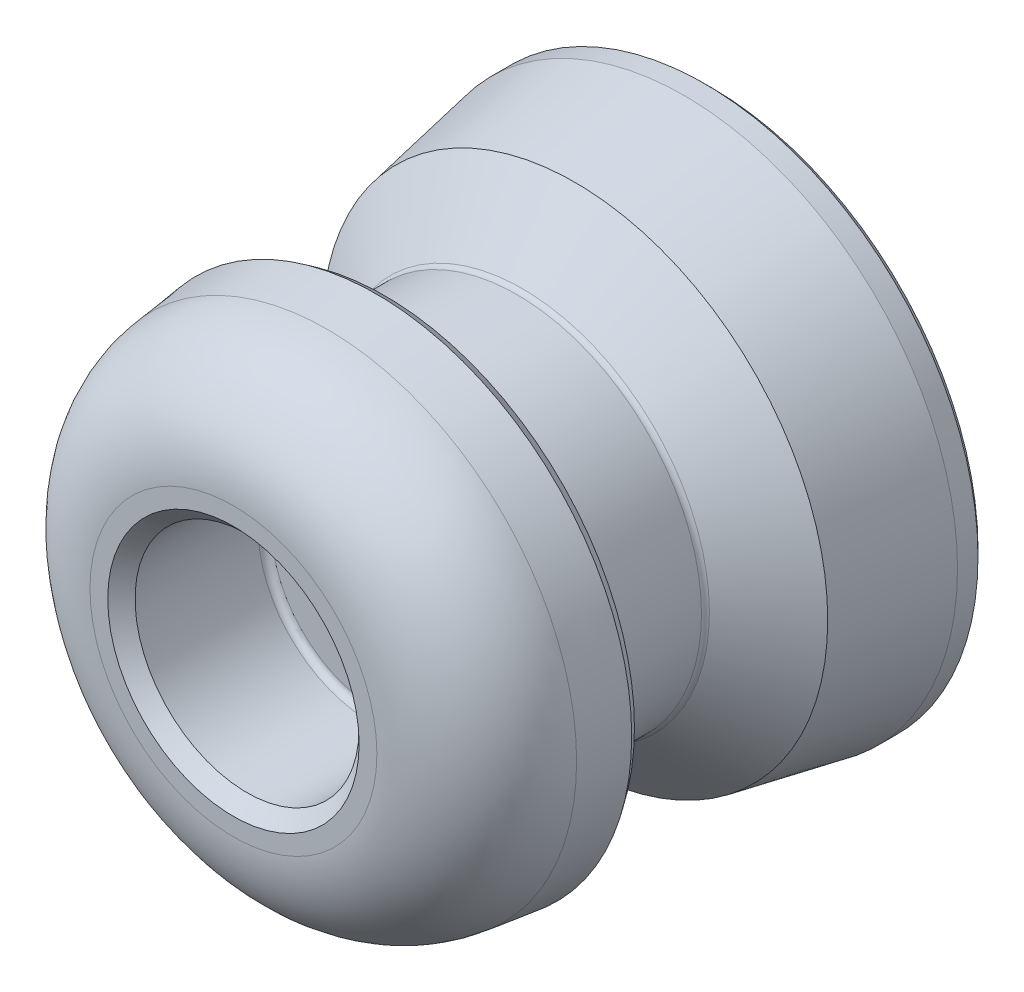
SolidWorks part; units mm, degrees
ref_plane "Přední rovina" through (0, 0, 0) normal (0, 0, 1) x (1, 0, 0)
ref_plane "Horní rovina" through (0, 0, 0) normal (0, 1, 0) x (1, 0, 0)
ref_plane "Pravá rovina" through (0, 0, 0) normal (1, 0, 0) x (0, 0, -1)
sketch "Skica1" plane through (0, 0, 0) normal (0, 1, 0) x (1, 0, 0)
  line L0 (0, -115.085) -> (0, 40.2996) construction
  line L1 (0, 0) -> (12.5, 0)
  line L2 (12.5, 0) -> (12.5, -5)
  line L3 (12.5, -5) -> (20, -5)
  line L4 (20, -5) -> (20, -7)
  line L5 (20, -7) -> (18.5, -15)
  line L6 (13.5, -19) -> (18.5, -15)
  line L7 (13.5, -19) -> (13.5, -28)
  line L8 (13.5, -28) -> (18.75, -29)
  line L9 (18.75, -29) -> (18.25, -33.1314)
  line L10 (10.5, -40) -> (0, -40)
  line L11 (0, -40) -> (0, 0)
  arc A0 (18.25, -33.1314) -> (10.5, -40) centre (10.5, -32.1934) cw
  point P16 (0, -37.3927)
  dimension "D1" = 25
  dimension "D2" = 5
  dimension "D3" = 40
  dimension "D4" = 40
  dimension "D5" = 27
  dimension "D6" = 21
  dimension "D7" = 36.5
  dimension "D8" = 11
  dimension "D9" = 37.5
  dimension "D10" = 12
  dimension "D11" = 2
  dimension "D12" = 9
  dimension "D13" = 10
  dimension "D14" = 37
revolve "Rotovat1" add sketch "Skica1" angle 360 about L0
sketch "Skica2" plane through (0, 0, 40) normal (0, 0, 1) x (1, 0, 0)
  circle A0 centre (0, 0) radius 8.2
  dimension "D1" = 16.4
extrude "Odebrat vysunutím1" cut sketch "Skica2" against normal blind 10.5
sketch "Skica3" plane through (0, 0, 40) normal (0, 0, 1) x (1, 0, 0)
  line L1 (2.8868, 5) -> (-2.8868, 5)
  line L2 (-2.8868, 5) -> (-5.7735, 0)
  line L3 (-5.7735, 0) -> (-2.8868, -5)
  line L4 (-2.8868, -5) -> (2.8868, -5)
  line L5 (2.8868, -5) -> (5.7735, 0)
  line L6 (5.7735, 0) -> (2.8868, 5)
  circle A0 centre (0, 0) radius 5 construction
  dimension "D1" = 10
extrude "Odebrat vysunutím2" cut sketch "Skica3" against normal blind 17
sketch "Skica4" plane through (0, 0, 40) normal (0, 0, 1) x (1, 0, 0)
  circle A0 centre (0, 0) radius 5
  dimension "D1" = 10
extrude "Odebrat vysunutím3" cut sketch "Skica4" against normal through all
chamfer "Zkosit1" distance 1 angle 45
chamfer "Zkosit2" distance 2 angle 45
chamfer "Zkosit3" distance 0.5 angle 45
fillet "Zaoblit1" radius 0.5
